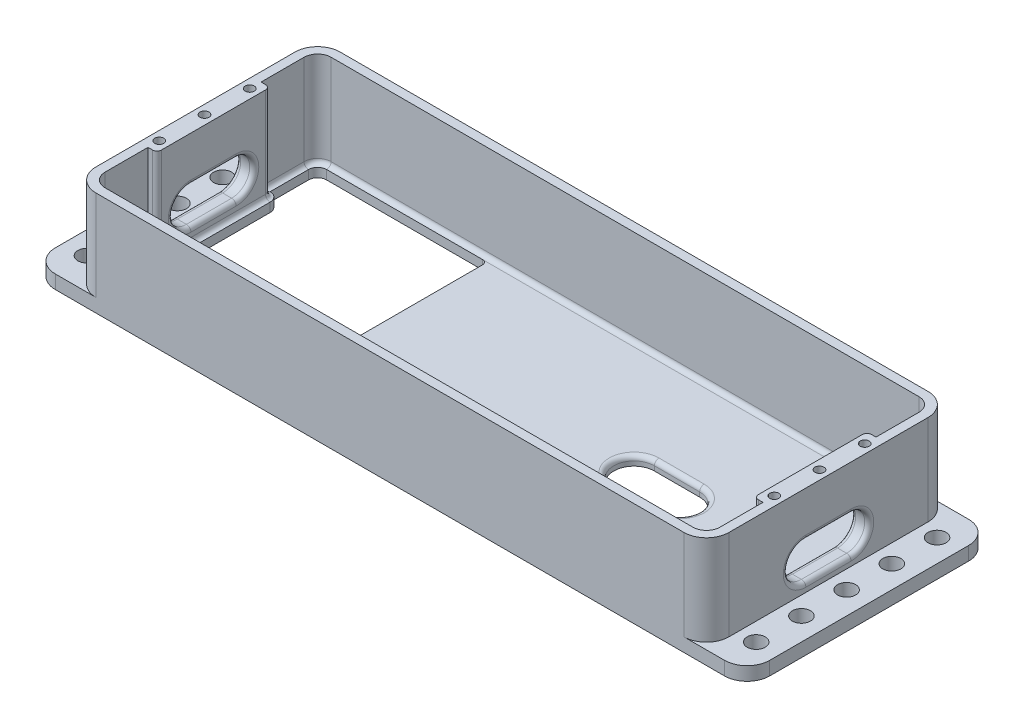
SolidWorks part; units mm, degrees
ref_plane "Front Plane" through (0, 0, 0) normal (0, 0, 1) x (1, 0, 0)
ref_plane "Top Plane" through (0, 0, 0) normal (0, 1, 0) x (1, 0, 0)
ref_plane "Right Plane" through (0, 0, 0) normal (1, 0, 0) x (0, 0, -1)
sketch "Sketch1" plane through (0, 0, 0) normal (0, 1, 0) x (1, 0, 0)
  line L1 (-79, 27) -> (79, 27)
  line L2 (-79, 27) -> (-79, -27)
  line L3 (-79, -27) -> (79, -27)
  line L4 (79, 27) -> (79, -27)
  line L5 (-79, 27) -> (79, -27) construction
  line L6 (-79, -27) -> (79, 27) construction
  point P0 (0, 0)
  dimension "D1" = 54
  dimension "D2" = 158
extrude "Boss-Extrude1" add sketch "Sketch1" along normal blind 3
sketch "Sketch6" plane through (0, 3, 0) normal (0, 1, 0) x (1, 0, 0)
  line L0 (-79, 0) -> (-74, 0)
  line L1 (-79, 27) -> (-79, -27) construction
  line L2 (-74, 0) -> (74, 0)
  line L3 (0, 27) -> (0, -27)
  line L4 (79, 27) -> (-79, 27) construction
  line L5 (-79, -27) -> (79, -27) construction
  circle A0 centre (-74, 0) radius 2
  circle A1 centre (-74, -10) radius 2
  circle A2 centre (-74, -20) radius 2
  circle A3 centre (-74, 0) radius 2
  circle A4 centre (-74, -10) radius 2
  circle A5 centre (-74, 10) radius 2
  circle A6 centre (-74, 0) radius 2
  circle A7 centre (-74, 10) radius 2
  circle A8 centre (-74, 20) radius 2
  circle A9 centre (74, 20) radius 2
  circle A10 centre (74, 10) radius 2
  circle A11 centre (74, 0) radius 2
  circle A12 centre (74, -10) radius 2
  circle A13 centre (74, -20) radius 2
  dimension "D2" = 3
  dimension "D1" = 5
  dimension "D3" = 3
extrude "Cut-Extrude1" cut sketch "Sketch6" against normal blind 15
fillet "Fillet1" radius 5 4 edges at (-79, 1.5, 27) (-79, 1.5, -27) (79, 1.5, -27) (79, 1.5, 27)
sketch "Sketch7" plane through (0, 3, 0) normal (0, 1, 0) x (1, 0, 0)
  line L0 (-79, 0) -> (32, 0)
  line L1 (-79, 22) -> (-79, -22) construction
  line L2 (27, 0) -> (37, 0) construction
  line L3 (27, 4.5) -> (37, 4.5)
  line L4 (27, -4.5) -> (37, -4.5)
  arc A0 (27, 4.5) -> (27, -4.5) centre (27, 0) ccw
  arc A1 (37, -4.5) -> (37, 4.5) centre (37, 0) ccw
  point P7 (32, 0)
  dimension "D1" = 111
  dimension "D2" = 10
  dimension "D3" = 9
extrude "Cut-Extrude2" cut sketch "Sketch7" against normal blind 15
sketch "Sketch8" plane through (0, 3, 0) normal (0, 1, 0) x (1, 0, 0)
  line L0 (-74, 0) -> (-70, 0)
  line L1 (-74, -27) -> (74, -27) construction
  line L2 (-70, -27) -> (70, -27)
  line L3 (-70, -27) -> (-70, 27)
  line L4 (-70, 27) -> (70, 27)
  line L5 (70, -27) -> (70, 27)
  line L6 (74, 27) -> (-74, 27) construction
  line L7 (-68, -25) -> (-68, 25)
  line L8 (-68, 25) -> (68, 25)
  line L9 (68, -25) -> (68, 25)
  line L10 (-68, -25) -> (68, -25)
  circle A0 centre (74, 0) radius 2 construction
  dimension "D1" = 4
  dimension "D2" = 4
  dimension "D3" = 2
extrude "Boss-Extrude3" add sketch "Sketch8" along normal blind 20 contours L4 L5 L2 L3
fillet "Fillet2" radius 5 4 edges at (-70, 13, -27) (70, 13, -27) (70, 13, 27) (-70, 13, 27)
shell "Shell2" thickness 2
sketch "Sketch9" plane through (0, 5, 0) normal (0, 1, 0) x (1, 0, 0)
  line L1 (17.5866, 9.9478) -> (51.1015, 9.9478)
  line L2 (17.5866, 9.9478) -> (17.5866, -12.9162)
  line L3 (17.5866, -12.9162) -> (51.1015, -12.9162)
  line L4 (51.1015, 9.9478) -> (51.1015, -12.9162)
extrude "Cut-Extrude3" cut sketch "Sketch9" against normal up to surface (3 mm away)
sketch "Sketch10" plane through (0, 23, 0) normal (0, 1, 0) x (1, 0, 0)
  line L0 (-70, 0) -> (-66, 0)
  line L1 (-70, -22) -> (-70, 22) construction
  line L2 (0, -25) -> (0, 25) construction
  line L3 (-70, 12.5) -> (-66, 12.5)
  line L4 (-70, 12.5) -> (-70, -12.5)
  line L5 (-70, -12.5) -> (-66, -12.5)
  line L6 (-66, 12.5) -> (-66, -12.5)
  line L7 (-70, 12.5) -> (-66, -12.5) construction
  line L8 (-70, -12.5) -> (-66, 12.5) construction
  line L9 (-65, -25) -> (65, -25) construction
  line L10 (65, 25) -> (-65, 25) construction
  line L11 (70, -12.5) -> (66, -12.5)
  line L12 (66, 12.5) -> (66, -12.5)
  line L13 (70, 12.5) -> (66, 12.5)
  line L14 (70, 12.5) -> (70, -12.5)
  point P5 (-68, 0)
  dimension "D1" = 25
extrude "Boss-Extrude4" add sketch "Sketch10" against normal up to surface (21 mm away) contours L6 L3 L0 M22 | L6 L0 L5 M22 | L13 L12 L11 M18
fillet "Fillet3" radius 1 4 edges at (66, 12.5, -12.5) (66, 12.5, 12.5) (-66, 12.5, 12.5) (-66, 12.5, -12.5)
sketch "Sketch11" plane through (0, 23, 0) normal (0, 1, 0) x (1, 0, 0)
  line L0 (-66, 0) -> (-70, 0)
  line L1 (-66, 11.5) -> (-66, -11.5) construction
  line L2 (-70, -22) -> (-70, 22) construction
  line L3 (-68, 10) -> (-68, -10)
  line L4 (0, 25) -> (0, 18.1842)
  line L5 (-65, 25) -> (65, 25) construction
  circle A0 centre (-68, 10) radius 1
  circle A1 centre (-68, -10) radius 1
  circle A2 centre (-68, 0) radius 1
  circle A3 centre (68, 10) radius 1
  circle A4 centre (68, 0) radius 1
  circle A5 centre (68, -10) radius 1
  point P9 (-68, 0)
  dimension "D1" = 20
extrude "Cut-Extrude4" cut sketch "Sketch11" against normal blind 6
sketch "Sketch13" plane through (-70, 0, 0) normal (-1, 0, 0) x (0, 0, 1)
  line L0 (0, 3) -> (0, 5)
  line L1 (-22, 3) -> (22, 3) construction
  line L2 (0, 5) -> (0, 9)
  line L3 (-5, 9) -> (5, 9) construction
  line L4 (-5, 13) -> (5, 13)
  line L5 (-5, 5) -> (5, 5)
  arc A0 (-5, 13) -> (-5, 5) centre (-5, 9) ccw
  arc A1 (5, 5) -> (5, 13) centre (5, 9) ccw
  point P8 (0, 9)
  dimension "D1" = 4
  dimension "D2" = 10
  dimension "D3" = 8
  dimension "D4" = 2
extrude "Cut-Extrude5" cut sketch "Sketch13" against normal blind 199
fillet "Fillet4" radius 1 20 edges at (-67.5, 2, 12.5) (-66.2929, 2, 12.2071) (-67.5, 2, -12.5) (-66.2929, 2, -12.2071) (-68, 2, 17.25) (-67.1213, 2, 24.1213) (0, 2, 25) (67.1213, 2, 24.1213) (67.5, 2, 12.5) (66.2929, 2, 12.2071) (66, 2, 0) (67.5, 2, -12.5) (68, 2, -17.25) (67.1213, 2, -24.1213) (-68, 2, -17.25) (-67.1213, 2, -24.1213) (-66, 2, 0) (68, 2, 17.25) (66.2929, 2, -12.2071) (0, 2, -25)
fillet "Fillet5" radius 1 16 edges at (70, 13, 0) (70, 9, 9) (70, 5, 0) (-70, 13, 0) (-70, 9, 9) (-70, 5, 0) (66, 13, 0) (66, 9, 9) (66, 5, 0) (-66, 13, 0) (-66, 9, 9) (-66, 5, 0) (70, 9, -9) (-70, 9, -9) (66, 9, -9) (-66, 9, -9)
fillet "Fillet6" radius 1 4 edges at (41.5, 2, 0) (32, 2, 4.5) (22.5, 2, 0) (32, 2, -4.5)
sketch "Sketch14" plane through (0, 2, 0) normal (0, 1, 0) x (1, 0, 0)
  line L0 (-59.9595, -20.088) -> (-61.9036, -16.5448)
  line L1 (-29.5, 24.5) -> (-78.5, 24.5)
  line L2 (-29.5, 24.5) -> (-29.5, -24.5)
  line L3 (-29.5, -24.5) -> (-78.5, -24.5)
  line L4 (-78.5, 24.5) -> (-78.5, -24.5)
  line L5 (-29.5, 24.5) -> (-31.4222, 22.5778) construction
  line L6 (-29.5, -24.5) -> (-32.5858, -21.4142) construction
  line L7 (-69.9595, -20.088) -> (-71.9036, -16.5448)
  line L8 (-71.9036, -16.5448) -> (-75.944, -16.4568)
  line L9 (-75.944, -16.4568) -> (-78.0405, -19.912)
  line L10 (-78.0405, -19.912) -> (-76.0964, -23.4552)
  line L11 (-76.0964, -23.4552) -> (-72.056, -23.5432)
  line L12 (-72.056, -23.5432) -> (-69.9595, -20.088)
  line L14 (-65.944, -16.4568) -> (-68.0405, -19.912)
  line L15 (-68.0405, -19.912) -> (-66.0964, -23.4552)
  line L16 (-66.0964, -23.4552) -> (-62.056, -23.5432)
  line L18 (-49.9595, -20.088) -> (-51.9036, -16.5448)
  line L20 (-55.944, -16.4568) -> (-58.0405, -19.912)
  line L22 (-56.0964, -23.4552) -> (-52.056, -23.5432)
  line L23 (-52.056, -23.5432) -> (-49.9595, -20.088)
  line L25 (-41.9036, -16.5448) -> (-45.944, -16.4568)
  line L26 (-45.944, -16.4568) -> (-48.0405, -19.912)
  line L27 (-48.0405, -19.912) -> (-46.0964, -23.4552)
  line L28 (-46.0964, -23.4552) -> (-42.056, -23.5432)
  line L30 (-29.9595, -20.088) -> (-31.9036, -16.5448)
  line L32 (-36.5479, -17.4521) -> (-38.0405, -19.912)
  line L34 (-36.0964, -23.4552) -> (-32.056, -23.5432)
  line L35 (-32.056, -23.5432) -> (-29.9595, -20.088)
  line L36 (-59.9595, -10.088) -> (-61.9036, -6.5448)
  line L38 (-65.944, -6.4568) -> (-68.0405, -9.912)
  line L39 (-68.0405, -9.912) -> (-66.0964, -13.4552)
  line L41 (-62.056, -13.5432) -> (-59.9595, -10.088)
  line L42 (-49.9595, -10.088) -> (-51.9036, -6.5448)
  line L43 (-51.9036, -6.5448) -> (-55.944, -6.4568)
  line L45 (-58.0405, -9.912) -> (-56.0964, -13.4552)
  line L47 (-52.056, -13.5432) -> (-49.9595, -10.088)
  line L48 (-39.9595, -10.088) -> (-41.9036, -6.5448)
  line L50 (-45.944, -6.4568) -> (-48.0405, -9.912)
  line L51 (-48.0405, -9.912) -> (-46.0964, -13.4552)
  line L53 (-42.056, -13.5432) -> (-39.9595, -10.088)
  line L54 (-29.9595, -10.088) -> (-31.9036, -6.5448)
  line L56 (-35.944, -6.4568) -> (-38.0405, -9.912)
  line L57 (-38.0405, -9.912) -> (-36.0964, -13.4552)
  line L59 (-32.056, -13.5432) -> (-29.9595, -10.088)
  line L62 (-65.944, 3.5432) -> (-68.0405, 0.088)
  line L63 (-68.0405, 0.088) -> (-66.0964, -3.4552)
  line L65 (-62.056, -3.5432) -> (-59.9595, -0.088)
  line L66 (-51.4222, 2.5778) -> (-51.9036, 3.4552)
  line L67 (-51.9036, 3.4552) -> (-55.944, 3.5432)
  line L68 (-55.944, 3.5432) -> (-58.0405, 0.088)
  line L69 (-56.5778, -2.5778) -> (-56.0964, -3.4552)
  line L70 (-56.0964, -3.4552) -> (-52.056, -3.5432)
  line L71 (-52.056, -3.5432) -> (-49.9595, -0.088)
  line L74 (-45.944, 3.5432) -> (-48.0405, 0.088)
  line L77 (-42.056, -3.5432) -> (-39.9595, -0.088)
  line L78 (-29.9595, -0.088) -> (-31.9036, 3.4552)
  line L80 (-35.944, 3.5432) -> (-38.0405, 0.088)
  line L81 (-38.0405, 0.088) -> (-36.0964, -3.4552)
  line L83 (-32.056, -3.5432) -> (-29.9595, -0.088)
  line L86 (-65.944, 13.5432) -> (-68.0405, 10.088)
  line L87 (-68.0405, 10.088) -> (-66.0964, 6.5448)
  line L89 (-62.056, 6.4568) -> (-61.4521, 7.4521)
  line L90 (-49.9595, 9.912) -> (-51.9036, 13.4552)
  line L91 (-51.9036, 13.4552) -> (-55.944, 13.5432)
  line L92 (-55.944, 13.5432) -> (-58.0405, 10.088)
  line L94 (-56.0964, 6.5448) -> (-52.056, 6.4568)
  line L96 (-41.4222, 12.5778) -> (-41.9036, 13.4552)
  line L99 (-48.0405, 10.088) -> (-46.5778, 7.4222)
  line L101 (-42.056, 6.4568) -> (-39.9595, 9.912)
  line L102 (-29.9595, 9.912) -> (-31.9036, 13.4552)
  line L107 (-32.056, 6.4568) -> (-29.9595, 9.912)
  line L109 (-61.9036, 23.4552) -> (-65.944, 23.5432)
  line L110 (-65.944, 23.5432) -> (-68.0405, 20.088)
  line L111 (-68.0405, 20.088) -> (-66.0964, 16.5448)
  line L115 (-51.9036, 23.4552) -> (-55.944, 23.5432)
  line L116 (-55.944, 23.5432) -> (-60.3493, 16.2828)
  line L117 (-58.0405, 20.088) -> (-56.0964, 16.5448)
  line L118 (-56.0964, 16.5448) -> (-52.056, 16.4568)
  line L120 (-39.9595, 19.912) -> (-41.9036, 23.4552)
  line L121 (-41.9036, 23.4552) -> (-45.944, 23.5432)
  line L126 (-29.9595, 19.912) -> (-31.9036, 23.4552)
  line L127 (-31.9036, 23.4552) -> (-35.944, 23.5432)
  line L129 (-36.5778, 17.4222) -> (-36.0964, 16.5448)
  line L132 (-69.9595, -10.088) -> (-71.9036, -6.5448)
  line L133 (-71.9036, -6.5448) -> (-75.944, -6.4568)
  line L134 (-75.944, -6.4568) -> (-78.0405, -9.912)
  line L135 (-78.0405, -9.912) -> (-76.0964, -13.4552)
  line L136 (-76.0964, -13.4552) -> (-72.056, -13.5432)
  line L137 (-72.056, -13.5432) -> (-69.9595, -10.088)
  line L138 (-69.9595, -0.088) -> (-71.9036, 3.4552)
  line L139 (-71.9036, 3.4552) -> (-75.944, 3.5432)
  line L140 (-75.944, 3.5432) -> (-78.0405, 0.088)
  line L141 (-78.0405, 0.088) -> (-76.0964, -3.4552)
  line L142 (-76.0964, -3.4552) -> (-72.056, -3.5432)
  line L143 (-72.056, -3.5432) -> (-69.9595, -0.088)
  line L144 (-69.9595, 9.912) -> (-71.9036, 13.4552)
  line L145 (-71.9036, 13.4552) -> (-75.944, 13.5432)
  line L146 (-75.944, 13.5432) -> (-78.0405, 10.088)
  line L147 (-78.0405, 10.088) -> (-76.0964, 6.5448)
  line L148 (-76.0964, 6.5448) -> (-72.056, 6.4568)
  line L149 (-72.056, 6.4568) -> (-69.9595, 9.912)
  line L150 (-69.9595, 19.912) -> (-71.9036, 23.4552)
  line L151 (-71.9036, 23.4552) -> (-75.944, 23.5432)
  line L152 (-75.944, 23.5432) -> (-78.0405, 20.088)
  line L153 (-78.0405, 20.088) -> (-76.0964, 16.5448)
  line L154 (-76.0964, 16.5448) -> (-72.056, 16.4568)
  line L155 (-72.056, 16.4568) -> (-69.9595, 19.912)
  line L156 (-68.0405, -19.912) -> (-69.9595, -20.088)
  line L157 (-65.4142, 11.4142) -> (-78.5, 24.5) construction
  line L158 (-68.7869, -24.5) -> (-29.5, -24.5)
  line L159 (-68.7869, -24.5) -> (-68.7869, 24.5)
  line L160 (-68.7869, 24.5) -> (-29.5, 24.5)
  line L161 (-29.5, -24.5) -> (-29.5, 24.5)
  line L162 (-62.056, 16.4568) -> (-59.9595, 19.912)
  line L163 (-59.9595, 19.912) -> (-61.9036, 23.4552)
  line L164 (-66.0964, 16.5448) -> (-62.056, 16.4568)
  line L165 (-61.9036, 13.4552) -> (-65.944, 13.5432)
  line L166 (-66.0964, 6.5448) -> (-62.056, 6.4568)
  line L167 (-59.9595, -0.088) -> (-61.9036, 3.4552)
  line L168 (-61.4521, 7.4521) -> (-62.5858, 8.5858) construction
  line L169 (-59.9595, 9.912) -> (-61.9036, 13.4552)
  line L170 (-58.0405, 10.088) -> (-56.0964, 6.5448)
  line L171 (-52.056, 6.4568) -> (-49.9595, 9.912)
  line L172 (-45.944, 13.5432) -> (-48.0405, 10.088)
  line L173 (-41.9036, 13.4552) -> (-45.944, 13.5432)
  line L174 (-46.0964, 16.5448) -> (-42.056, 16.4568)
  line L175 (-45.944, 23.5432) -> (-48.0405, 20.088)
  line L176 (-49.9595, 19.912) -> (-51.9036, 23.4552)
  line L177 (-52.056, 16.4568) -> (-49.9595, 19.912)
  line L178 (-48.0405, 20.088) -> (-46.0964, 16.5448)
  line L179 (-42.056, 16.4568) -> (-39.9595, 19.912)
  line L180 (-36.5778, 17.4222) -> (-42.5858, 11.4142) construction
  line L181 (-36.0964, 16.5448) -> (-32.056, 16.4568)
  line L182 (-31.9036, 13.4552) -> (-35.944, 13.5432)
  line L183 (-36.0964, 6.5448) -> (-32.056, 6.4568)
  line L184 (-31.9036, 3.4552) -> (-35.944, 3.5432)
  line L185 (-36.0964, -3.4552) -> (-32.056, -3.5432)
  line L186 (-31.9036, -6.5448) -> (-35.944, -6.4568)
  line L187 (-36.0964, -13.4552) -> (-32.056, -13.5432)
  line L188 (-31.9036, -16.5448) -> (-35.944, -16.4568)
  line L189 (-42.5858, -11.4142) -> (-46.5479, -7.4521) construction
  line L190 (-39.9595, -20.088) -> (-41.9036, -16.5448)
  line L191 (-42.056, -23.5432) -> (-39.9595, -20.088)
  line L192 (-38.0405, -19.912) -> (-36.0964, -23.4552)
  line L193 (-35.4142, -18.5858) -> (-36.5479, -17.4521) construction
  line L194 (-46.0964, -13.4552) -> (-42.056, -13.5432)
  line L195 (-41.9036, -6.5448) -> (-45.944, -6.4568)
  line L196 (-46.0964, -3.4552) -> (-42.056, -3.5432)
  line L197 (-41.9036, 3.4552) -> (-45.944, 3.5432)
  line L198 (-46.0964, 6.5448) -> (-42.056, 6.4568)
  line L199 (-46.5778, 7.4222) -> (-54, 0) construction
  line L200 (-48.0405, 0.088) -> (-46.0964, -3.4552)
  line L201 (-51.4521, -2.5479) -> (-52.5858, -1.4142) construction
  line L202 (-39.9595, -0.088) -> (-41.9036, 3.4552)
  line L203 (-38.0405, 10.088) -> (-36.0964, 6.5448)
  line L204 (-35.944, 23.5432) -> (-38.0405, 20.088)
  line L205 (-32.056, 16.4568) -> (-29.9595, 19.912)
  line L206 (-35.944, 13.5432) -> (-38.0405, 10.088)
  line L207 (-54, 0) -> (-56.5479, 2.5479) construction
  line L208 (-55.4142, -1.4142) -> (-56.5778, -2.5778) construction
  line L209 (-62.5858, -8.5858) -> (-78.5, -24.5) construction
  line L210 (-55.944, -6.4568) -> (-58.0405, -9.912)
  line L211 (-56.0964, -13.4552) -> (-52.056, -13.5432)
  line L212 (-51.9036, -16.5448) -> (-55.944, -16.4568)
  line L213 (-58.0405, -19.912) -> (-56.0964, -23.4552)
  line L214 (-62.056, -23.5432) -> (-59.9595, -20.088)
  line L215 (-61.9036, -16.5448) -> (-65.944, -16.4568)
  line L216 (-66.0964, -13.4552) -> (-62.056, -13.5432)
  line L217 (-61.9036, -6.5448) -> (-65.944, -6.4568)
  line L218 (-66.0964, -3.4552) -> (-62.056, -3.5432)
  line L219 (-61.9036, 3.4552) -> (-65.944, 3.5432)
  circle A0 centre (-74, -20) radius 2
  arc A5 (-62.5858, -8.5858) -> (-65.4142, -11.4142) centre (-64, -10) ccw
  arc A7 (-45.4142, -8.5858) -> (-42.5858, -11.4142) centre (-44, -10) ccw
  arc A10 (-52.5858, 1.4142) -> (-55.4142, 1.4142) centre (-54, 0) ccw
  circle A21 centre (-74, -10) radius 2
  circle A22 centre (-74, 0) radius 2
  circle A23 centre (-74, 10) radius 2
  circle A24 centre (-74, 20) radius 2
  circle A25 centre (-74, -20) radius 3.5 construction
  circle A26 centre (-64, 20) radius 2
  arc A27 (-65.4142, 11.4142) -> (-62.5858, 8.5858) centre (-64, 10) ccw
  circle A28 centre (-54, 10) radius 2
  circle A29 centre (-44, 20) radius 2
  circle A30 centre (-54, 20) radius 2
  circle A31 centre (-34, 10) radius 2
  circle A32 centre (-34, 0) radius 2
  circle A33 centre (-34, -10) radius 2
  circle A34 centre (-44, -20) radius 2
  arc A35 (-32.5858, -21.4142) -> (-35.4142, -18.5858) centre (-34, -20) ccw
  arc A36 (-45.4142, 8.5858) -> (-42.5858, 11.4142) centre (-44, 10) ccw
  circle A37 centre (-44, 0) radius 2
  arc A38 (-32.5858, 21.4142) -> (-35.4142, 18.5858) centre (-34, 20) ccw
  arc A39 (-55.4142, -1.4142) -> (-52.5858, -1.4142) centre (-54, 0) ccw
  circle A40 centre (-54, -10) radius 2
  circle A41 centre (-54, -20) radius 2
  circle A42 centre (-64, -20) radius 2
  circle A43 centre (-64, 0) radius 2
  dimension "D4" = 4.5
  dimension "D5" = 7
  dimension "D1" = 5
  dimension "D2" = 5
  dimension "D6" = 5
  dimension "D7" = 5
extrude "Cut-Extrude6" cut sketch "Sketch14" against normal blind 11
fillet "Fillet7" radius 1 2 edges at (-29.5, 1, -24) (-29.5, 1, 24)
